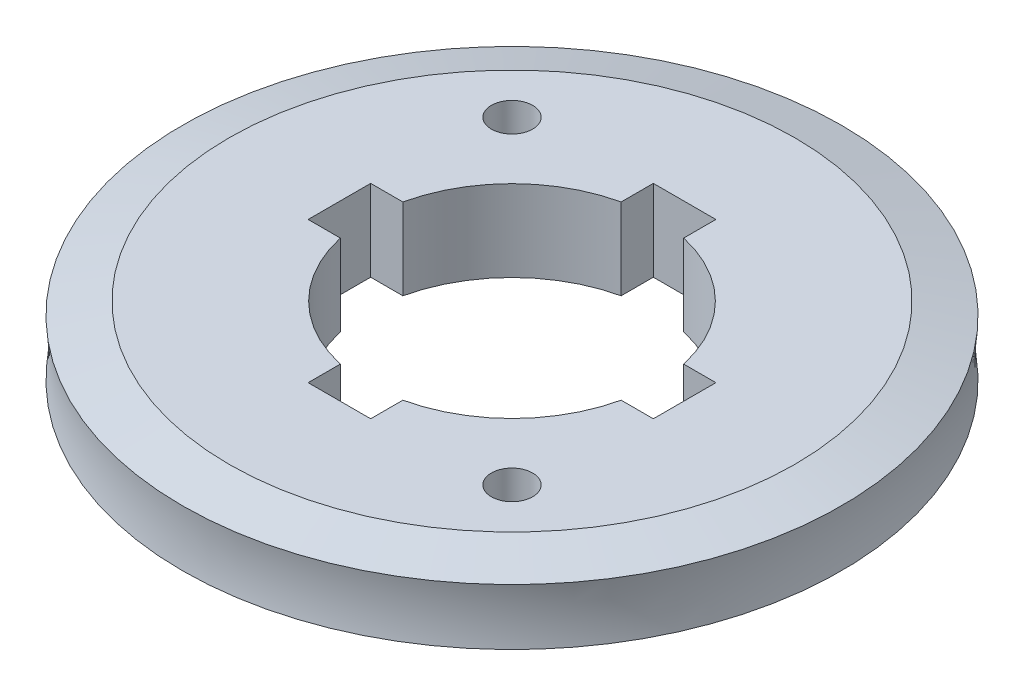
SolidWorks part; units mm, degrees
ref_plane "Face" through (0, 0, 0) normal (0, 0, 1) x (1, 0, 0)
ref_plane "Dessus" through (0, 0, 0) normal (0, 1, 0) x (1, 0, 0)
ref_plane "Droite" through (0, 0, 0) normal (1, 0, 0) x (0, 0, -1)
sketch "Esquisse1" plane through (0, 0, 0) normal (0, 0, 1) x (1, 0, 0)
  line L0 (0, 0) -> (0, 32.4443) construction
  line L1 (3, 0) -> (22.6179, 0)
  line L2 (22.6179, 0) -> (26.35, 1)
  line L4 (26.35, 5.5) -> (22.6179, 6.5)
  line L5 (22.6179, 6.5) -> (10, 6.5)
  line L6 (10, 6.5) -> (10, 16.5)
  line L7 (10, 16.5) -> (3, 16.5)
  line L8 (3, 16.5) -> (3, 0)
  arc A0 (26.35, 5.5) -> (26.35, 1) centre (42.191, 3.25) ccw
  dimension "D5" = 32
  dimension "D1" = 6
  dimension "D2" = 20
  dimension "D3" = 15
  dimension "D4" = 15
  dimension "D6" = 1
  dimension "D7" = 52.7
  dimension "D8" = 6.5
  dimension "D9" = 10
revolve "Révolution1" add sketch "Esquisse1" angle 360 about L0
sketch "Esquisse2" plane through (0, 16.5, 0) normal (0, 1, 0) x (-1, 0, 0)
  circle A0 centre (0, 0) radius 10 construction
  circle A1 centre (0, 0) radius 10
extrude "Enlèv. mat.-Extru.1" cut sketch "Esquisse2" against normal up to surface (10 mm away)
sketch "Esquisse5" plane through (0, 6.5, 0) normal (0, 1, 0) x (-1, 0, 0)
  circle A0 centre (0, 0) radius 11.5
  circle A1 centre (0, 0) radius 3 construction
  dimension "D1" = 23
extrude "Enlèv. mat.-Extru.2" cut sketch "Esquisse5" against normal through all
sketch "Esquisse7" plane through (0, 0, 0) normal (0, -1, 0) x (1, 0, 0)
  circle A0 centre (0, 0) radius 14.25
  dimension "D1" = 28.5
extrude "Enlèv. mat.-Extru.4" cut sketch "Esquisse7" against normal blind 0.3 flip side to cut
sketch "Esquisse8" plane through (0, 6.5, 0) normal (0, 1, 0) x (-1, 0, 0)
  line L0 (-28.1161, 0) -> (27.961, 0) construction
  line L1 (0, 31.6064) -> (0, -28.8142) construction
  line L2 (11.225, -2.5) -> (11.225, 2.5)
  line L3 (-13.8, -2.5) -> (-11.225, -2.5)
  line L4 (-13.8, -2.5) -> (-13.8, 2.5)
  line L5 (-13.8, 2.5) -> (-11.225, 2.5)
  line L6 (-11.225, -2.5) -> (-11.225, 2.5)
  line L7 (13.8, 2.5) -> (11.225, 2.5)
  line L8 (13.8, -2.5) -> (13.8, 2.5)
  line L9 (13.8, -2.5) -> (11.225, -2.5)
  line L10 (2.5, -13.8) -> (2.5, -11.225)
  line L11 (2.5, 13.8) -> (-2.5, 13.8)
  line L12 (2.5, -13.8) -> (-2.5, -13.8)
  line L13 (2.5, 11.225) -> (-2.5, 11.225)
  line L14 (-2.5, 13.8) -> (-2.5, 11.225)
  line L15 (2.5, 13.8) -> (2.5, 11.225)
  line L16 (-2.5, -13.8) -> (-2.5, -11.225)
  line L17 (2.5, -11.225) -> (-2.5, -11.225)
  circle A0 centre (0, 0) radius 11.5 construction
  dimension "D1" = 5
  dimension "D2" = 2.3
extrude "Enlèv. mat.-Extru.5" cut sketch "Esquisse8" against normal through all
sketch "Esquisse9" plane through (0, 0.3, 0) normal (0, -1, 0) x (1, 0, 0)
  line L0 (21.6675, 21.6675) -> (-21.6675, -21.6675) construction
  line L1 (0, 29.6673) -> (0, -30.5981) construction
  circle A0 centre (0, 0) radius 18 construction
  circle A1 centre (12.7279, 12.7279) radius 1.65
  circle A2 centre (-12.7279, -12.7279) radius 1.65
  dimension "D2" = 36
  dimension "D3" = 3.3
  dimension "D1" = 45
extrude "Enlèv. mat.-Extru.6" cut sketch "Esquisse9" against normal through all
